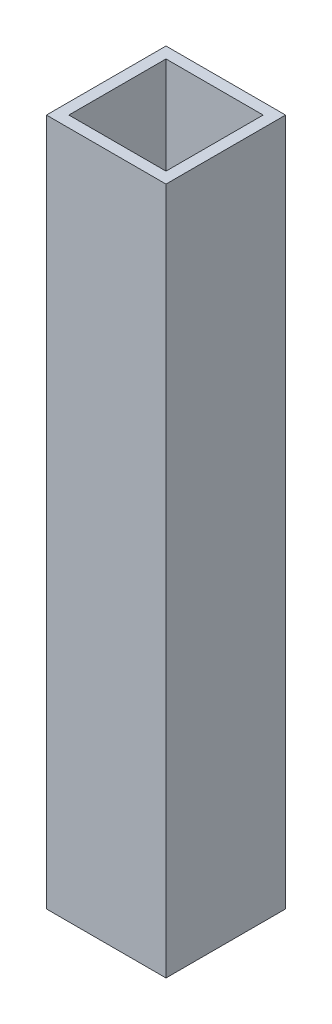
SolidWorks part; units mm, degrees
ref_plane "Front Plane" through (0, 0, 0) normal (0, 0, 1) x (1, 0, 0)
ref_plane "Top Plane" through (0, 0, 0) normal (0, 1, 0) x (1, 0, 0)
ref_plane "Right Plane" through (0, 0, 0) normal (1, 0, 0) x (0, 0, -1)
ref_plane "Plane1" through (0, 146.05, 0) normal (0, 1, 0) x (-1, 0, 0)
sketch "Sketch1" plane through (0, 146.05, 0) normal (0, 1, 0) x (-1, 0, 0)
  line L0 (-20.6375, 4.7625) -> (-20.6375, 46.0375)
  line L1 (-20.6375, 46.0375) -> (20.6375, 46.0375)
  line L2 (20.6375, 46.0375) -> (20.6375, 4.7625)
  line L3 (20.6375, 4.7625) -> (-20.6375, 4.7625)
  line L4 (-25.4, 0) -> (25.4, 0)
  line L5 (25.4, 0) -> (25.4, 50.8)
  line L6 (25.4, 50.8) -> (-25.4, 50.8)
  line L7 (-25.4, 50.8) -> (-25.4, 0)
extrude "Boss-Extrude1" add sketch "Sketch1" against normal blind 292.1
